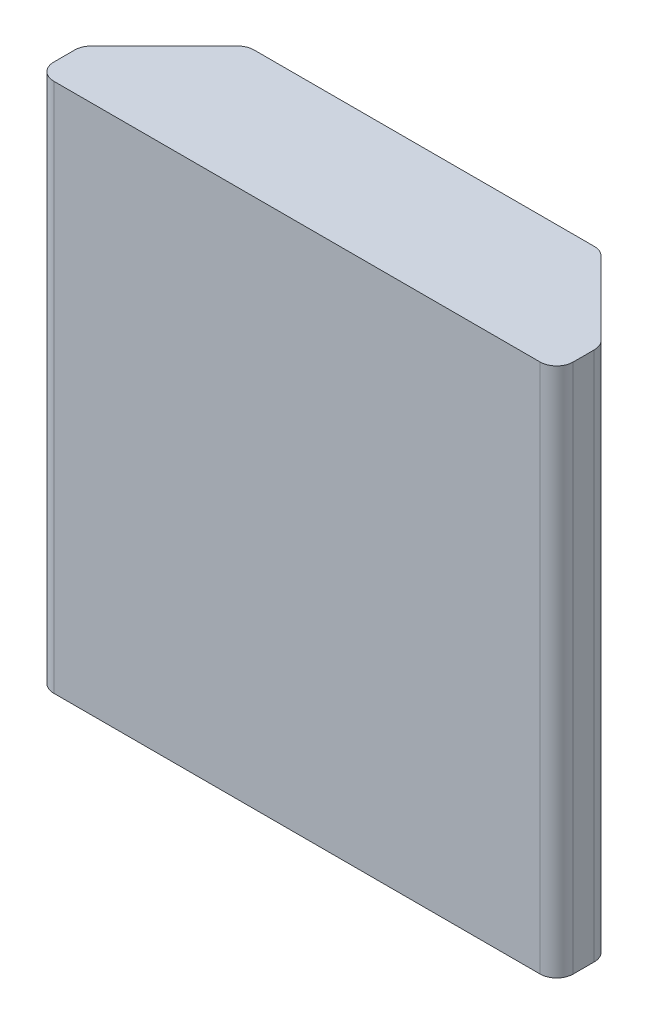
SolidWorks part; units mm, degrees
ref_plane "Front Plane" through (0, 0, 0) normal (0, 0, 1) x (1, 0, 0)
ref_plane "Top Plane" through (0, 0, 0) normal (0, 1, 0) x (1, 0, 0)
ref_plane "Right Plane" through (0, 0, 0) normal (1, 0, 0) x (0, 0, -1)
sketch "Sketch1" plane through (0, 0, 0) normal (0, 1, 0) x (1, 0, 0)
  line L0 (-6.223, 0) -> (6.223, 0) construction
  line L1 (-6.223, 0.3969) -> (-6.223, 0.8992)
  line L2 (-6.1068, 1.1799) -> (-4.3549, 2.9318)
  line L3 (-4.0742, 3.048) -> (4.0742, 3.048)
  line L4 (4.3549, 2.9318) -> (6.1068, 1.1799)
  line L5 (6.223, 0.8992) -> (6.223, 0.3969)
  line L6 (-6.223, 1.0636) -> (6.223, 1.0636) construction
  line L7 (-5.8261, 0) -> (5.8261, 0)
  arc A0 (6.1068, 1.1799) -> (6.223, 0.8992) centre (5.8261, 0.8992) cw
  arc A1 (-6.1068, 1.1799) -> (-6.223, 0.8992) centre (-5.8261, 0.8992) ccw
  arc A2 (4.3549, 2.9318) -> (4.0742, 3.048) centre (4.0742, 2.6511) ccw
  arc A3 (-4.0742, 3.048) -> (-4.3549, 2.9318) centre (-4.0742, 2.6511) ccw
  arc A4 (6.223, 0.3969) -> (5.8261, 0) centre (5.8261, 0.3969) cw
  arc A5 (-5.8261, 0) -> (-6.223, 0.3969) centre (-5.8261, 0.3969) cw
  dimension "D6" = 0.3969
  dimension "D1" = 12.446
  dimension "D2" = 45
  dimension "D3" = 45
  dimension "D4" = 1.0636
  dimension "D5" = 3.048
extrude "Boss-Extrude1" add sketch "Sketch1" along normal blind 12.7
equation "\"D4@Sketch1\"=3/64in-0.005"
